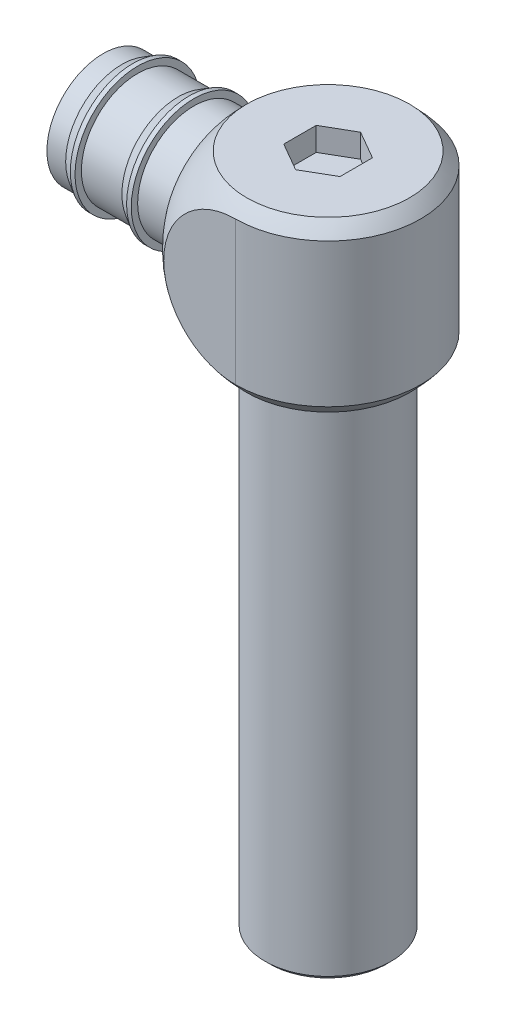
SolidWorks part; units mm, degrees
ref_plane "Front Plane" through (0, 0, 0) normal (0, 0, 1) x (1, 0, 0)
ref_plane "Top Plane" through (0, 0, 0) normal (0, 1, 0) x (1, 0, 0)
ref_plane "Right Plane" through (0, 0, 0) normal (1, 0, 0) x (0, 0, -1)
ref_plane "Plane1" through (0, 22.9489, 0) normal (0, 1, 0) x (-1, 0, 0)
sketch "Sketch1" plane through (0, 0, 0) normal (0, 0, 1) x (1, 0, 0)
  line L0 (0, 0) -> (0, 50000) construction
  line L1 (0, 42.7927) -> (0, 3.1052)
  line L2 (55, 22.9489) -> (-55, 22.9489) construction
  arc A1 (0, 3.1052) -> (0, 42.7927) centre (0, 22.9489) ccw
  dimension "D1" = 39.6875
revolve "Revolve1" add sketch "Sketch1" angle 360 about L0
sketch "Sketch3" plane through (0, 0, 0) normal (0, 1, 0) x (1, 0, 0)
  line L0 (2.5806, 0) -> (50002.5806, 0) construction
  line L1 (0, -15.6845) -> (-15.6845, -15.6845)
  line L2 (-15.6845, -15.6845) -> (-15.6845, 15.6845)
  line L3 (0, 15.6845) -> (-15.6845, 15.6845)
  circle A0 centre (0, 0) radius 15.6845 construction
  arc A1 (0, -15.6845) -> (0, 15.6845) centre (0, 0) ccw
  point P12 (-15.6845, 0)
  dimension "D1" = 31.369
extrude "Cut-Extrude1" cut sketch "Sketch3" against normal through all and the other way through all flip side to cut
sketch "Sketch4" plane through (0, 0, 0) normal (0, 0, 1) x (1, 0, 0)
  line L0 (0, 0) -> (0, 50000) construction
  line L1 (-25.4, 37.2364) -> (25.4, 37.2364)
  line L2 (-25.4, 37.2364) -> (-25.4, 8.6614)
  line L3 (-25.4, 8.6614) -> (25.4, 8.6614)
  line L4 (25.4, 37.2364) -> (25.4, 8.6614)
  line L5 (0, 10.7928) -> (0, 35.105) construction
  line L6 (0, 22.9489) -> (50000, 22.9489) construction
  line L7 (17.2529, 22.9489) -> (-17.2529, 22.9489) construction
  point P8 (0, 22.9489)
  dimension "D1" = 28.575
  dimension "D2" = 50.8
extrude "Cut-Extrude2" cut sketch "Sketch4" against normal through all and the other way through all flip side to cut
sketch "Sketch9" plane through (0, 22.9489, 0) normal (0, 1, 0) x (1, 0, 0)
  line L0 (0, 0) -> (50000, 0) construction
  line L1 (-38.1, 0) -> (-38.1, 9.525)
  line L2 (-38.1, 9.525) -> (-34.925, 9.525)
  line L3 (-34.925, 9.525) -> (-33.0553, 10.6045)
  line L4 (-33.0553, 10.6045) -> (-32.2615, 10.6045)
  line L5 (-32.2615, 10.6045) -> (-32.2615, 9.525)
  line L6 (-32.2615, 9.525) -> (-25.4, 9.525)
  line L7 (-25.4, 9.525) -> (-23.5303, 10.6045)
  line L8 (-23.5303, 10.6045) -> (-22.7365, 10.6045)
  line L9 (-22.7365, 10.6045) -> (-22.7365, 9.525)
  line L10 (-22.7365, 9.525) -> (0, 9.525)
  line L11 (0, 9.525) -> (0, 0)
  line L12 (-38.1, 0) -> (0, 0)
  line L13 (0, 0) -> (0, 50000) construction
  dimension "D1" = 19.05
  dimension "D2" = 1.0795
  dimension "D4" = 25.4
  dimension "D5" = 3.175
  dimension "D6" = 38.1
  dimension "D7" = 0.7937
  dimension "D8" = 30
revolve "Revolve2" add sketch "Sketch9" angle 360 about L0
fillet "Fillet1" radius 1.1906 1 edges at (-15.6845, 22.9489, -9.525)
sketch "Sketch10" plane through (-38.1, 0, 0) normal (-1, 0, 0) x (0, 0, 1)
  circle A0 centre (0, 22.9489) radius 8.255
  circle A1 centre (0, 22.9489) radius 9.525 construction
  circle A2 centre (0, 22.9489) radius 9.525 construction
  dimension "D1" = 1.27
extrude "Cut-Extrude3" cut sketch "Sketch10" against normal up to surface (38.1 mm away)
sketch "Sketch11" plane through (0, 0, 0) normal (0, 0, 1) x (1, 0, 0)
  line L3 (10.668, -76.3016) -> (10.668, 5.4864)
  line L4 (9.906, -77.0636) -> (10.668, -76.3016)
  line L5 (0, -77.0636) -> (9.906, -77.0636)
  line L7 (-13.771, 8.6614) -> (13.771, 8.6614) construction
  line L8 (10.668, 5.4864) -> (10.668, 8.6614)
  line L9 (0, 8.6614) -> (10.668, 8.6614)
  line L10 (0, -76.5294) -> (0, 49923.4706) construction
  line L11 (0, -77.0636) -> (0, 8.6614)
  dimension "D1" = 85.725
  dimension "D2" = 3.175
  dimension "D3" = 21.336
  dimension "D4" = 0
  dimension "D5" = 45
  dimension "D6" = 0.762
revolve "Revolve3" add sketch "Sketch11" angle 360 about L10
sketch "Sketch12" plane through (0, -77.0636, 0) normal (0, -1, 0) x (1, 0, 0)
  circle A0 centre (0, 0) radius 13.771 construction
  circle A1 centre (0, 0) radius 7.9375
  dimension "D1" = 15.875
extrude "Cut-Extrude4" cut sketch "Sketch12" against normal blind 108.2802
sketch "Sketch13" plane through (0, 37.2364, 0) normal (0, 1, 0) x (1, 0, 0)
  line L0 (0, -17.2529) -> (0, 17.2529) construction
  line L1 (4.7625, -2.7496) -> (4.7625, 2.7496)
  line L2 (4.7625, 2.7496) -> (0, 5.4993)
  line L3 (0, 5.4993) -> (-4.7625, 2.7496)
  line L4 (-4.7625, 2.7496) -> (-4.7625, -2.7496)
  line L5 (-4.7625, -2.7496) -> (0, -5.4993)
  line L6 (0, -5.4993) -> (4.7625, -2.7496)
  circle A0 centre (0, 0) radius 4.7625 construction
  circle A1 centre (0, 0) radius 13.771 construction
  dimension "D1" = 9.525
extrude "Cut-Extrude5" cut sketch "Sketch13" against normal blind 3.9688
